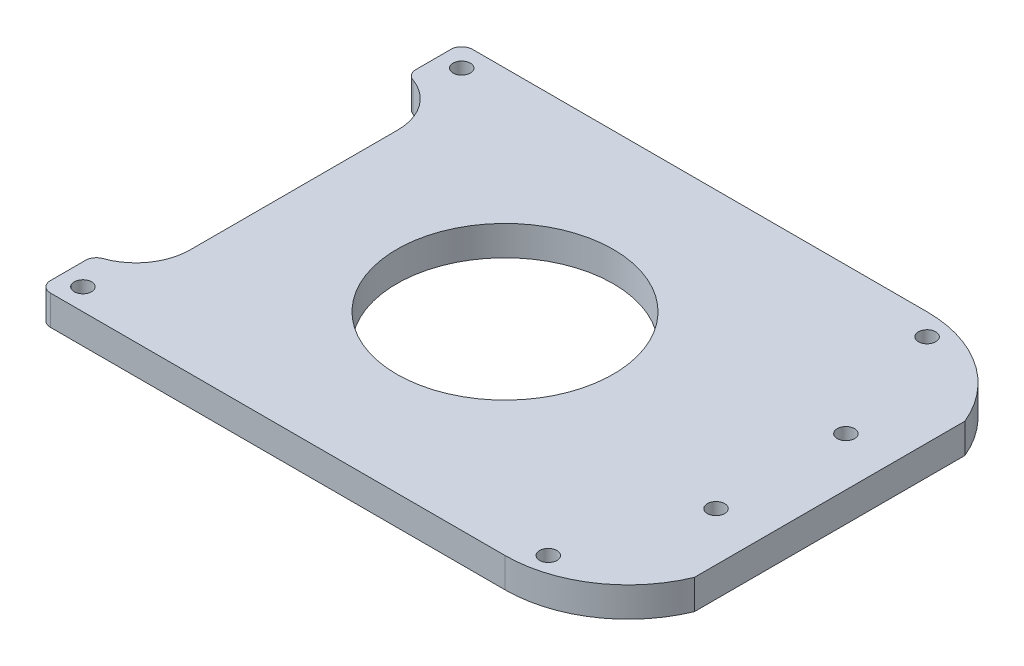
SolidWorks part; units mm, degrees
ref_plane "Front Plane" through (0, 0, 0) normal (0, 0, 1) x (1, 0, 0)
ref_plane "Top Plane" through (0, 0, 0) normal (0, 1, 0) x (1, 0, 0)
ref_plane "Right Plane" through (0, 0, 0) normal (1, 0, 0) x (0, 0, -1)
sketch "Sketch2" plane through (0, 0, 0) normal (0, 1, 0) x (1, 0, 0)
  line L0 (-39, 39) -> (-47, 39)
  line L1 (0, 39) -> (39, 39)
  line L3 (39, -39) -> (-39, -39)
  line L4 (-39, -29) -> (-39, 29)
  line L5 (-39, 39) -> (0, 39)
  line L8 (60, 0) -> (60, 25)
  line L9 (60, 0) -> (60, -25)
  line L11 (-47, 39) -> (-47, 29)
  line L12 (-47, 29) -> (-39, 29)
  line L13 (-39, -39) -> (-47, -39)
  line L14 (-47, -39) -> (-47, -29)
  line L15 (-47, -29) -> (-39, -29)
  circle A5 centre (51, 12) radius 1.6
  circle A6 centre (51, -12) radius 1.6
  circle A7 centre (0, 0) radius 20
  circle A8 centre (43, 35) radius 1.6
  circle A9 centre (43, -35) radius 1.6
  circle A10 centre (-43, -35) radius 1.6
  circle A11 centre (-43, 35) radius 1.6
  arc A12 (39, 39) -> (60, 25) centre (39, 16.25) cw
  arc A13 (39, -39) -> (60, -25) centre (39, -16.25) ccw
extrude "Boss-Extrude1" add sketch "Sketch2" along normal blind 5.5
fillet "Fillet1" radius 10 2 edges at (-39, 2.75, 29) (-39, 2.75, -29)
fillet "Fillet2" radius 2 1 edges at (-47, 2.75, 39)
fillet "Fillet3" radius 2 1 edges at (-47, 2.75, 29)
fillet "Fillet4" radius 2 1 edges at (-47, 2.75, -29)
fillet "Fillet5" radius 2 1 edges at (-47, 2.75, -39)
